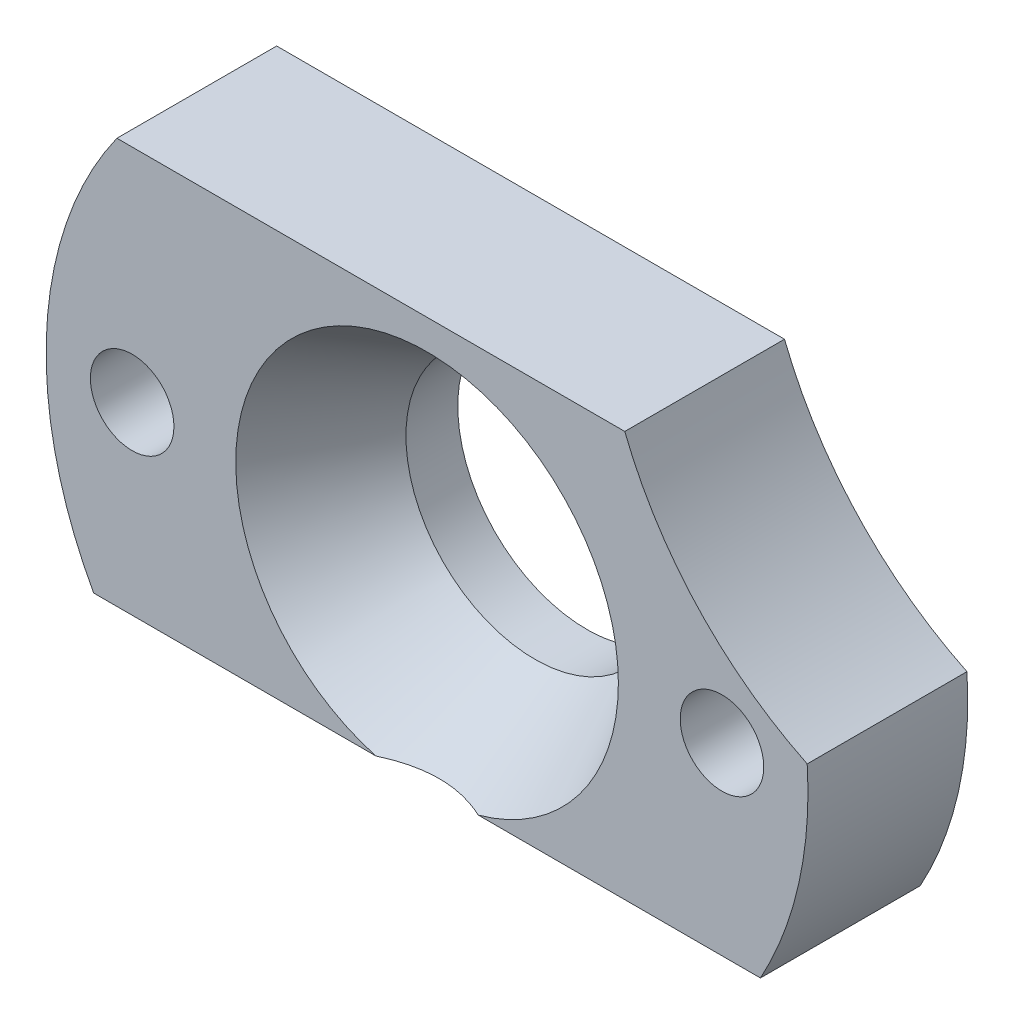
SolidWorks part; units mm, degrees
ref_plane "Vorne" through (0, 0, 0) normal (0, 0, 1) x (1, 0, 0)
ref_plane "Oben" through (0, 0, 0) normal (0, 1, 0) x (1, 0, 0)
ref_plane "Rechts" through (0, 0, 0) normal (1, 0, 0) x (0, 0, -1)
sketch "Skizze1" plane through (0, 0, 0) normal (0, 0, 1) x (1, 0, 0)
  line L0 (0, -15.6019) -> (0, 36.0403) construction
  line L1 (13.5647, -7.5) -> (-13.5647, -7.5)
  line L2 (12.6194, 9) -> (-12.6194, 9)
  arc A0 (13.5647, -7.5) -> (12.6194, 9) centre (0, 0) ccw
  arc A1 (-13.5647, -7.5) -> (-12.6194, 9) centre (0, 0) cw
  point P10 (0, -7.5)
  point P11 (0, 9)
  dimension "D1" = 15.5
  dimension "D2" = 7.5
  dimension "D3" = 16.5
extrude "Linear austragen1" add sketch "Skizze1" along normal blind 6.5
hole_wizard "Ø3.4 (3.4) Durchmesser Bohrung1" positions "Skizze3" profile "Skizze2" hole size "Ø3.4" standard "ISO"
sketch "Skizze3" plane through (0, 0, 6.5) normal (0, 0, 1) x (1, 0, 0)
  point P1 (-12, 0)
  point P3 (12, 0)
  dimension "D1" = 12
  dimension "D2" = 12
sketch "Skizze2" plane through (-12, 0, 6.5) normal (1, 0, 0) x (0, -1, 0)
  line L0 (0, 0) -> (0, 6.5)
  line L1 (0, 6.5) -> (1.7, 6.5)
  line L2 (1.7, 6.5) -> (1.7, 0)
  line L5 (1.7, 0) -> (0, 0)
  line L11 (0, -6.35) -> (0, 107.95) construction
  dimension "Bohrerdurchmesser" = 3.4
  dimension "Bohrungstiefe" = 6.5
hole_wizard "Formsenkung für M1.6 Linsensenkschraube mit Schlitz1" positions "Skizze5" profile "Skizze4" countersink size "M1.6" standard "ISO"
sketch "Skizze5" plane through (0, 0, 6.5) normal (0, 0, 1) x (1, 0, 0)
  point P0 (0, 0)
sketch "Skizze4" plane through (0, 0, 6.5) normal (1, 0, 0) x (0, -1, 0)
  line L0 (0, 0) -> (0, 6.5)
  line L1 (0, 6.5) -> (5.25, 6.5)
  line L2 (5.25, 6.5) -> (5.25, 4.39)
  line L3 (5.25, 4.39) -> (7.7846, 0)
  line L5 (7.7846, 0) -> (0, 0)
  line L6 (-5.25, 4.39) -> (-7.7846, 0) construction
  line L11 (0, -6.35) -> (0, 107.95) construction
  dimension "Bohrerdurchmesser" = 10.5
  dimension "Bohrungstiefe" = 6.5
  dimension "Senkwinkel (Oben)" = 60
sketch "Skizze7" plane through (0, 0, 0) normal (0, 0, -1) x (-1, 0, 0)
  line L0 (0, 0) -> (0, 29.5733) construction
  circle A0 centre (-22, 14.5) radius 15
  dimension "D1" = 22
  dimension "D3" = 30
  dimension "D2" = 14.5
extrude "Schnitt-Linear austragen1" cut sketch "Skizze7" against normal through all
